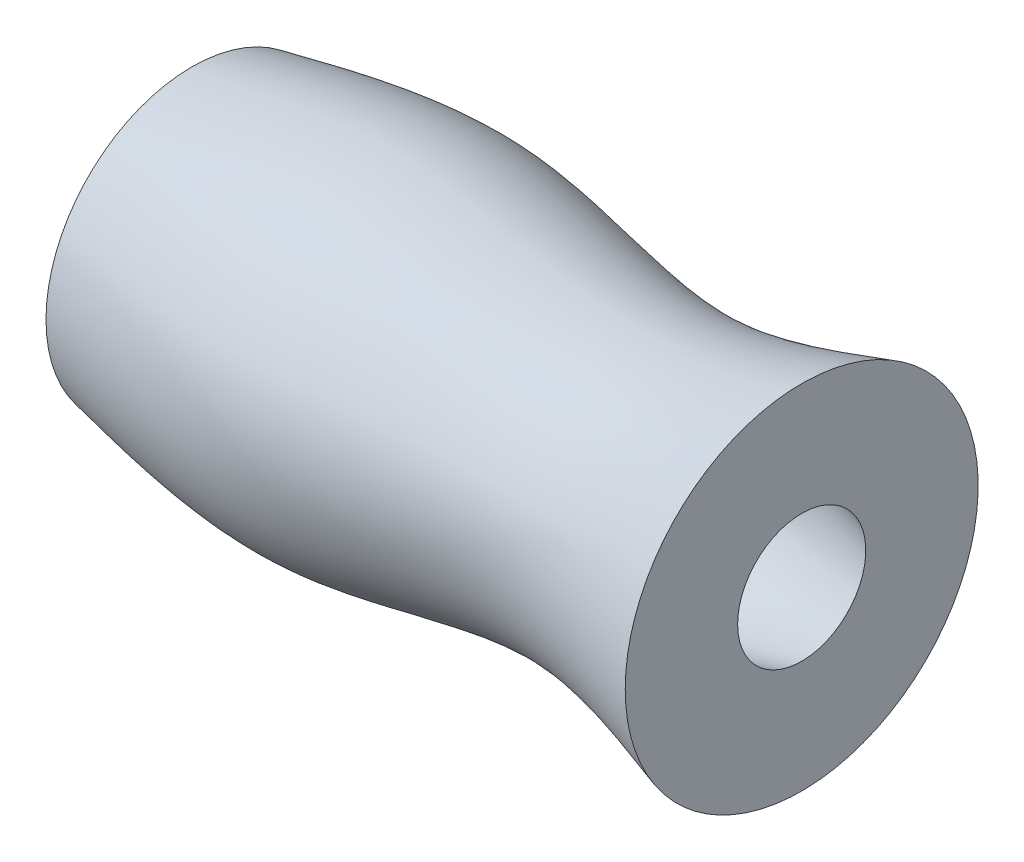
SolidWorks part; units mm, degrees
ref_plane "Ebene vorne" through (0, 0, 0) normal (0, 0, 1) x (1, 0, 0)
ref_plane "Ebene oben" through (0, 0, 0) normal (0, 1, 0) x (1, 0, 0)
ref_plane "Ebene rechts" through (0, 0, 0) normal (1, 0, 0) x (0, 0, -1)
sketch "Skizze1" plane through (0, 0, 0) normal (0, 0, 1) x (1, 0, 0)
  line L0 (0, 26.1097) -> (0, 0)
  line L1 (109.0524, 31.5623) -> (109.0524, 0)
  line L2 (0, 0) -> (109.0524, 0)
  spline S0 degree 3 poles (0, 26.1097) (12.7857, 28.7375) (39.2954, 34.186) (75.9492, 21.0821) (99.2281, 28.452) (109.0524, 31.5623) knots 0 0 0 0 0.350002 0.725686 1 1 1 1
revolve "Rotation1" add sketch "Skizze1" angle 360 about L2
sketch "Skizze2" plane through (0, 0, 0) normal (0, 0, 1) x (1, 0, 0)
  line L0 (0, 26.1097) -> (0, -26.1097) construction
  line L1 (109.0524, -31.5623) -> (109.0524, 31.5623) construction
  line L2 (0, 0) -> (0, 19.3176)
  line L3 (0, 0) -> (109.0524, 0)
  line L4 (109.0524, 0) -> (109.0524, 11.4596)
  spline S0 degree 3 poles (0, 19.3176) (4.9326, 18.3695) (16.0547, 16.2319) (35.3593, 23.5973) (56.9361, 6.9727) (83.3189, 18.2884) (100.9265, 13.6159) (109.0524, 11.4596) knots 0 0 0 0 0.134447 0.303155 0.515433 0.776373 1 1 1 1
revolve "Schnitt-Rotation1" cut sketch "Skizze2" angle 360 about L3
